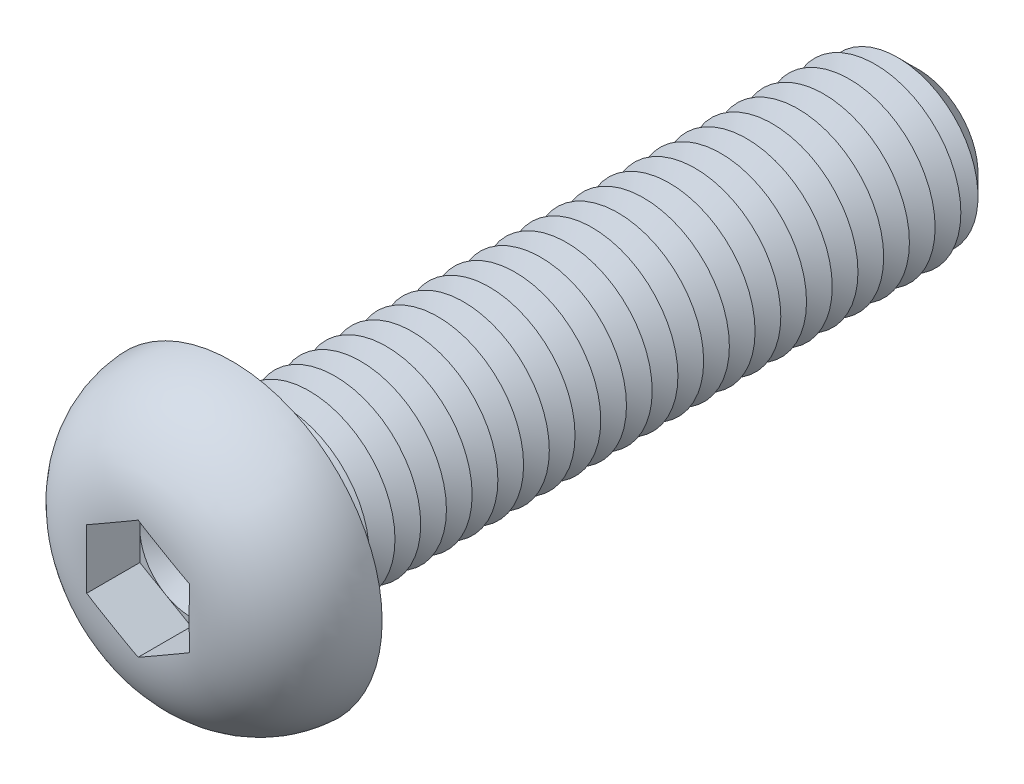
SolidWorks part; units mm, degrees
ref_plane "Front Plane" through (0, 0, 0) normal (0, 0, 1) x (1, 0, 0)
ref_plane "Top Plane" through (0, 0, 0) normal (0, 1, 0) x (1, 0, 0)
ref_plane "Right Plane" through (0, 0, 0) normal (1, 0, 0) x (0, 0, -1)
sketch "Sketch1" plane through (0, 0, 0) normal (1, 0, 0) x (0, 0, -1)
  line L0 (-47.9342, 0) -> (60.3146, 0) construction
sketch "Sketch2" plane through (0, 0, 0) normal (1, 0, 0) x (0, 0, -1)
  line L0 (0, 0) -> (-5.5, 0)
  line L1 (-47.9342, 0) -> (60.3146, 0) construction
  line L2 (-5.5, 0) -> (-5.5, 2.9578)
  line L3 (0, 8.75) -> (0, 0)
  arc A0 (-5.5, 2.9578) -> (0, 8.75) centre (0.3, 2.9578) cw
  dimension "D1" = 5.8
  dimension "D2" = 5.5
  dimension "D3" = 8.75
revolve "Revolve1" add sketch "Sketch2" angle 360 about L0
sketch "Sketch3" plane through (0, 0, 5.5) normal (0, 0, 1) x (1, 0, 0)
  line L1 (0, 3.4641) -> (-3, 1.7321)
  line L2 (-3, 1.7321) -> (-3, -1.7321)
  line L3 (-3, -1.7321) -> (0, -3.4641)
  line L4 (0, -3.4641) -> (3, -1.7321)
  line L5 (3, -1.7321) -> (3, 1.7321)
  line L6 (3, 1.7321) -> (0, 3.4641)
  circle A0 centre (0, 0) radius 3 construction
  dimension "D1" = 6
extrude "Cut-Extrude1" cut sketch "Sketch3" against normal blind 3.12
sketch "Sketch4" plane through (0, 0, 0) normal (0, 0, -1) x (-1, 0, 0)
  circle A0 centre (0, 0) radius 5
  dimension "D1" = 10
extrude "Boss-Extrude1" add sketch "Sketch4" along normal blind 40
chamfer "Chamfer1" distance 1.5 angle 45 1 edges at (-5, 0, -40)
sketch "Sketch5" plane through (0, 0, 0) normal (1, 0, 0) x (0, 0, -1)
  line L0 (1.5, 5) -> (3, 5)
  line L1 (38.5, 5) -> (0, 5) construction
  line L2 (3, 5) -> (2.25, 3.701)
  line L3 (2.25, 3.701) -> (1.5, 5)
  line L4 (0, -8.75) -> (0, 8.75) construction
  line L5 (38.5, 5) -> (0, 5) construction
  dimension "D1" = 1.5
  dimension "D2" = 1.5
revolve "Cut-Revolve1" cut sketch "Sketch5" angle 360 about L0
pattern_linear "LPattern1" count 25 spacing 1.5 along (0, 0, -1) of "Cut-Revolve1"
fillet "Fillet2" radius 0.6 1 edges at (5, 0, 0)
sketch "Sketch6" plane through (0, 0, 2.38) normal (0, 0, 1) x (1, 0, 0)
  line L0 (0, -3.4641) -> (3, -1.7321) construction
  circle A0 centre (0, 0) radius 3
extrude "Cut-Extrude2" cut sketch "Sketch6" against normal through all draft 60
